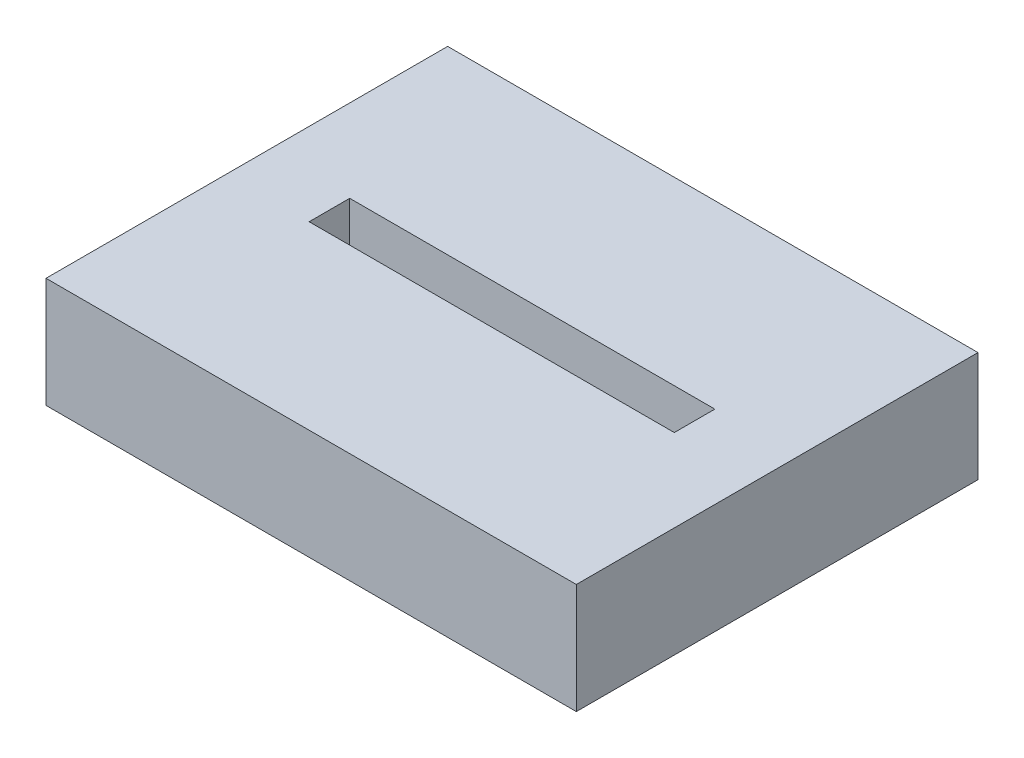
SolidWorks part; units mm, degrees
ref_plane "Plan de face" through (0, 0, 0) normal (0, 0, 1) x (1, 0, 0)
ref_plane "Plan de dessus" through (0, 0, 0) normal (0, 1, 0) x (1, 0, 0)
ref_plane "Plan de droite" through (0, 0, 0) normal (1, 0, 0) x (0, 0, -1)
sketch "Esquisse1" plane through (0, 0, 0) normal (0, 1, 0) x (1, 0, 0)
  line L1 (-22.875, 17.325) -> (22.875, 17.325)
  line L2 (-22.875, 17.325) -> (-22.875, -17.325)
  line L3 (-22.875, -17.325) -> (22.875, -17.325)
  line L4 (22.875, 17.325) -> (22.875, -17.325)
  line L5 (-22.875, 17.325) -> (22.875, -17.325) construction
  line L6 (-22.875, -17.325) -> (22.875, 17.325) construction
  point P0 (0, 0)
  dimension "D1" = 45.75
  dimension "D2" = 34.65
extrude "Boss.-Extru.1" add sketch "Esquisse1" along normal blind 9.5
sketch "Esquisse2" plane through (0, 9.5, 0) normal (0, 1, 0) x (1, 0, 0)
  line L1 (-15.75, 1.75) -> (15.75, 1.75)
  line L2 (-15.75, 1.75) -> (-15.75, -1.75)
  line L3 (-15.75, -1.75) -> (15.75, -1.75)
  line L4 (15.75, 1.75) -> (15.75, -1.75)
  line L5 (-15.75, 1.75) -> (15.75, -1.75) construction
  line L6 (-15.75, -1.75) -> (15.75, 1.75) construction
  point P0 (0, 0)
  dimension "D1" = 3.5
  dimension "D2" = 31.5
extrude "Enlèv. mat.-Extru.1" cut sketch "Esquisse2" against normal blind 5
